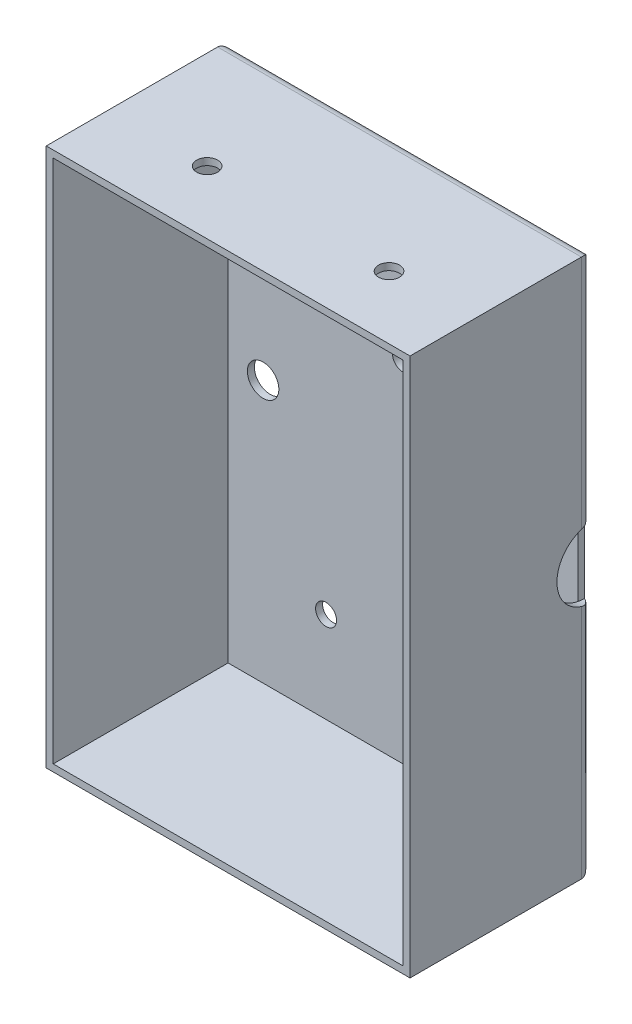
SolidWorks part; units mm, degrees
ref_plane "Face" through (0, 0, 0) normal (0, 0, 1) x (1, 0, 0)
ref_plane "Dessus" through (0, 0, 0) normal (0, 1, 0) x (1, 0, 0)
ref_plane "Droite" through (0, 0, 0) normal (1, 0, 0) x (0, 0, -1)
sketch "Esquisse1" plane through (0, 0, 0) normal (0, 0, 1) x (1, 0, 0)
  line L1 (0, 0) -> (52, 0)
  line L2 (0, 0) -> (0, 77)
  line L3 (0, 77) -> (52, 77)
  line L4 (52, 0) -> (52, 77)
  dimension "D1" = 52
  dimension "D2" = 77
extrude "Extrusion1" add sketch "Esquisse1" along normal blind 26
sketch "Esquisse2" plane through (0, 0, 26) normal (0, 0, 1) x (1, 0, 0)
  line L0 (0, 77) -> (0, 0) construction
  line L1 (1, 76) -> (51, 76)
  line L2 (1, 76) -> (1, 1)
  line L3 (1, 1) -> (51, 1)
  line L4 (51, 76) -> (51, 1)
  line L5 (52, 77) -> (0, 77) construction
  line L6 (52, 0) -> (52, 77) construction
  line L7 (0, 0) -> (52, 0) construction
  dimension "D1" = 1
  dimension "D2" = 1
  dimension "D3" = 1
  dimension "D4" = 1
extrude "Enlèv. mat.-Extru.1" cut sketch "Esquisse2" against normal blind 25
fillet "Congé1" radius 1.5
sketch "Esquisse3" plane through (0, 0, 0) normal (0, 0, -1) x (-1, 0, 0)
  line L0 (-46, 38.5) -> (-6, 38.5) construction
  line L1 (-6, 38.5) -> (0, 38.5) construction
  line L2 (0, 77) -> (0, 0) construction
  line L3 (-26, 38.5) -> (-26, 77) construction
  line L4 (-52, 77) -> (0, 77) construction
  circle A0 centre (-46, 38.5) radius 2.25
  circle A1 centre (-6, 38.5) radius 2.25
  dimension "D1" = 4.5
  dimension "D2" = 40
extrude "Enlèv. mat.-Extru.2" cut sketch "Esquisse3" against normal through all
sketch "Esquisse4" plane through (0, 0, 0) normal (0, 0, -1) x (-1, 0, 0)
  line L0 (-37, 14) -> (-15, 14) construction
  line L1 (-26, 14) -> (-26, 0) construction
  line L2 (0, 0) -> (-52, 0) construction
  line L3 (-26, 51) -> (-26, 14) construction
  line L4 (-38.3757, 74.75) -> (-23.6243, 74.75)
  line L5 (-39.6562, 63.25) -> (-22.3438, 63.25)
  line L6 (-21.3528, 64.3836) -> (-22.6332, 73.8836)
  line L7 (-40.6472, 64.3836) -> (-39.3668, 73.8836)
  line L8 (-31, 74.75) -> (-31, 63.25) construction
  line L10 (-43.5, 69) -> (-18.5, 69) construction
  line L11 (-51, 76) -> (-1, 76) construction
  line L12 (0, 77) -> (0, 0) construction
  circle A0 centre (-37, 14) radius 1.5
  circle A1 centre (-15, 14) radius 1.5
  circle A2 centre (-26, 51) radius 1.5
  arc A3 (-23.6243, 74.75) -> (-22.6332, 73.8836) centre (-23.6243, 73.75) cw
  arc A4 (-22.3438, 63.25) -> (-21.3528, 64.3836) centre (-22.3438, 64.25) ccw
  arc A5 (-39.6562, 63.25) -> (-40.6472, 64.3836) centre (-39.6562, 64.25) cw
  arc A6 (-38.3757, 74.75) -> (-39.3668, 73.8836) centre (-38.3757, 73.75) ccw
  circle A7 centre (-43.5, 69) radius 1.5
  circle A8 centre (-18.5, 69) radius 1.5
  point P18 (-22.75, 74.75)
  point P21 (-21.2, 63.25)
  point P24 (-40.8, 63.25)
  point P27 (-39.25, 74.75)
  dimension "D1" = 3
  dimension "D2" = 22
  dimension "D3" = 14
  dimension "D4" = 37
  dimension "D8" = 1
  dimension "D10" = 3
  dimension "D11" = 25
  dimension "D14" = 12.5
  dimension "D5" = 16.5
  dimension "D6" = 19.6
  dimension "D7" = 11.5
  dimension "D9" = 31
  dimension "D12" = 5.75
  dimension "D13" = 7
extrude "Enlèv. mat.-Extru.3" cut sketch "Esquisse4" against normal through all
sketch "Esquisse5" plane through (0, 77, 0) normal (0, 1, 0) x (-1, 0, 0)
  line L0 (-40, 17) -> (-14, 17) construction
  line L1 (-52, 26) -> (-52, 1.5) construction
  line L2 (-1.5, 0) -> (-50.5, 0) construction
  circle A0 centre (-40, 17) radius 1.5
  circle A1 centre (-14, 17) radius 1.5
  dimension "D1" = 3
  dimension "D2" = 26
  dimension "D3" = 12
  dimension "D4" = 17
extrude "Enlèv. mat.-Extru.4" cut sketch "Esquisse5" against normal up to next
sketch "Esquisse6" plane through (52, 0, 0) normal (1, 0, 0) x (0, 0, -1)
  line L0 (0, 75.5) -> (0, 1.5) construction
  line L1 (0, 43.5) -> (0, 33.5)
  line L2 (0, 38.5) -> (-2.2583, 38.5) construction
  line L3 (-26, 0) -> (-1.5, 0) construction
  arc A0 (0, 33.5) -> (0, 43.5) centre (0, 38.5) cw
  dimension "D1" = 10
  dimension "D2" = 38.5
extrude "Enlèv. mat.-Extru.5" cut sketch "Esquisse6" against normal blind 1
